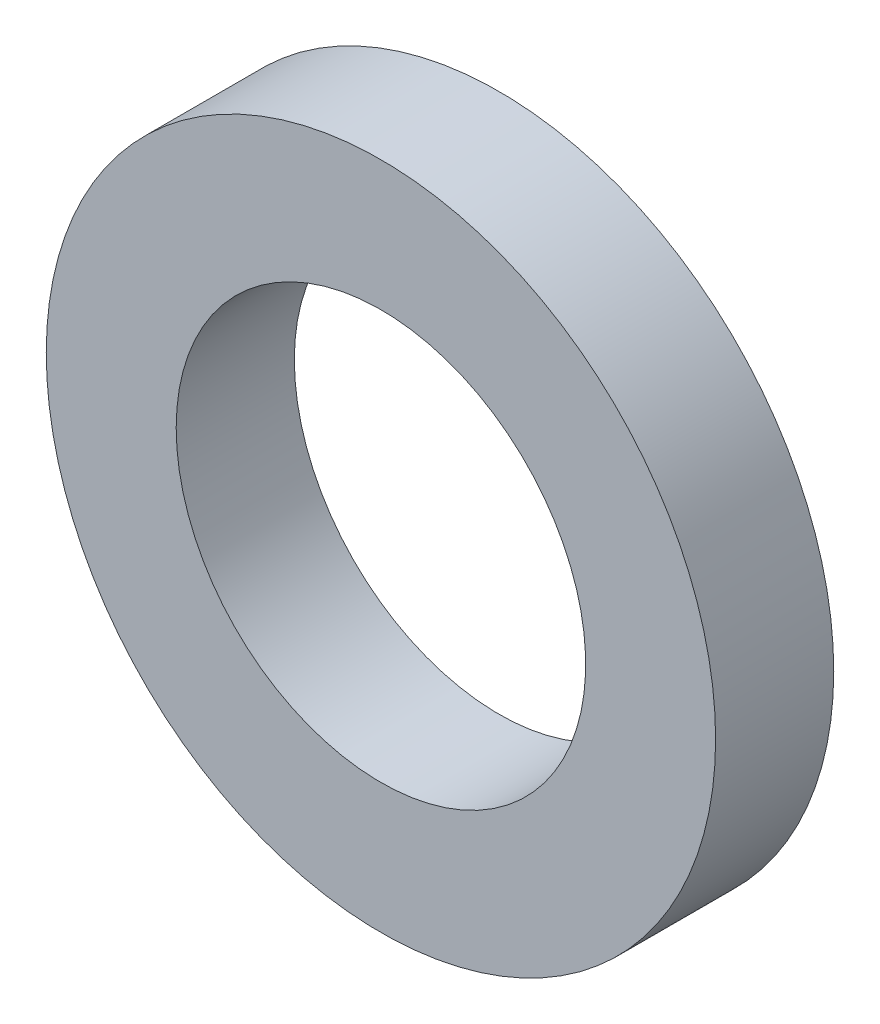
SolidWorks part; units mm, degrees
ref_plane "Plan de face" through (0, 0, 0) normal (0, 0, 1) x (1, 0, 0)
ref_plane "Plan de dessus" through (0, 0, 0) normal (0, 1, 0) x (1, 0, 0)
ref_plane "Plan de droite" through (0, 0, 0) normal (1, 0, 0) x (0, 0, -1)
sketch "Esquisse1" plane through (0, 0, 0) normal (1, 0, 0) x (0, 0, -1)
  line L0 (0, 0) -> (-6.2248, 0) construction
  line L1 (-0.75, 4.25) -> (0.75, 4.25)
  line L2 (-0.75, 4.25) -> (-0.75, 2.6)
  line L3 (-0.75, 2.6) -> (0.75, 2.6)
  line L4 (0.75, 4.25) -> (0.75, 2.6)
  line L5 (-0.75, 4.25) -> (0.75, 2.6) construction
  line L6 (-0.75, 2.6) -> (0.75, 4.25) construction
  point P0 (0, 3.425)
  dimension "D1" = 5.2
  dimension "D2" = 8.5
  dimension "D3" = 1.5
revolve "Révolution1" add sketch "Esquisse1" angle 360 about L0
